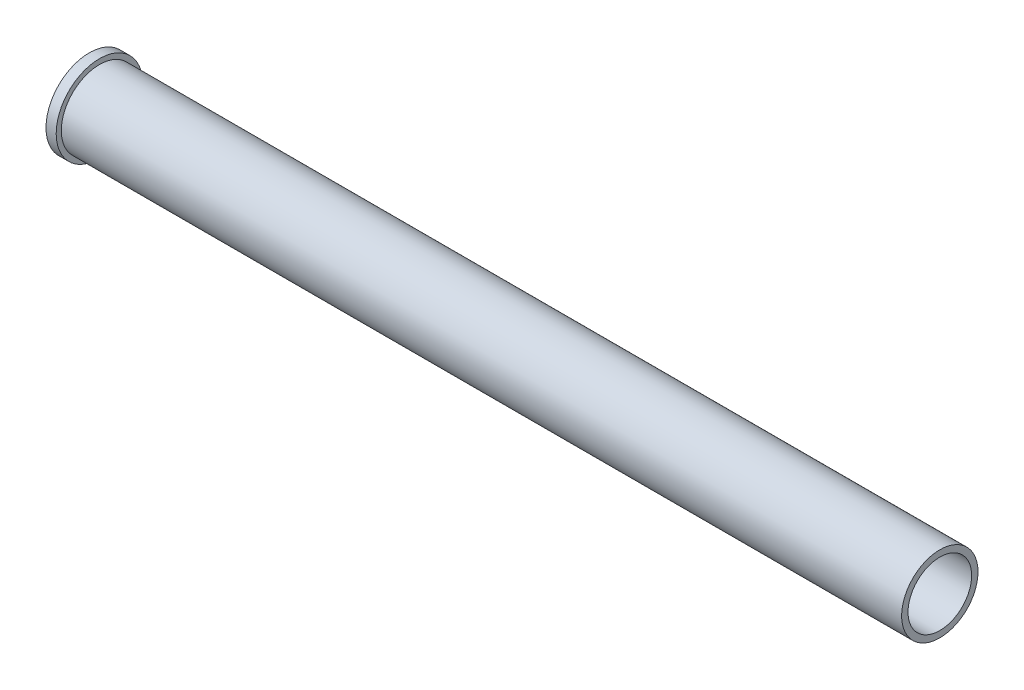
SolidWorks part; units mm, degrees
ref_plane "Front Plane" through (0, 0, 0) normal (0, 0, 1) x (1, 0, 0)
ref_plane "Top Plane" through (0, 0, 0) normal (0, 1, 0) x (1, 0, 0)
ref_plane "Right Plane" through (0, 0, 0) normal (1, 0, 0) x (0, 0, -1)
sketch "Sketch1" plane through (0, 0, 0) normal (1, 0, 0) x (0, 0, -1)
  circle A0 centre (0, 0) radius 5
  circle A1 centre (0, 0) radius 7.5
  dimension "D1" = 10
  dimension "D2" = 15
extrude "Boss-Extrude1" add sketch "Sketch1" along normal blind 165.1
sketch "Sketch2" plane through (165.1, 0, 0) normal (1, 0, 0) x (0, 0, -1)
  circle A0 centre (0, 0) radius 6.25
  dimension "D1" = 12.5
extrude "Cut-Extrude1" cut sketch "Sketch2" against normal blind 25.4
sketch "Sketch3" plane through (0, 0, 0) normal (-1, 0, 0) x (0, 0, 1)
  circle A0 centre (0, 0) radius 5
  circle A1 centre (0, 0) radius 8.5
  dimension "D1" = 10
  dimension "D2" = 17
extrude "Boss-Extrude2" add sketch "Sketch3" along normal blind 2
